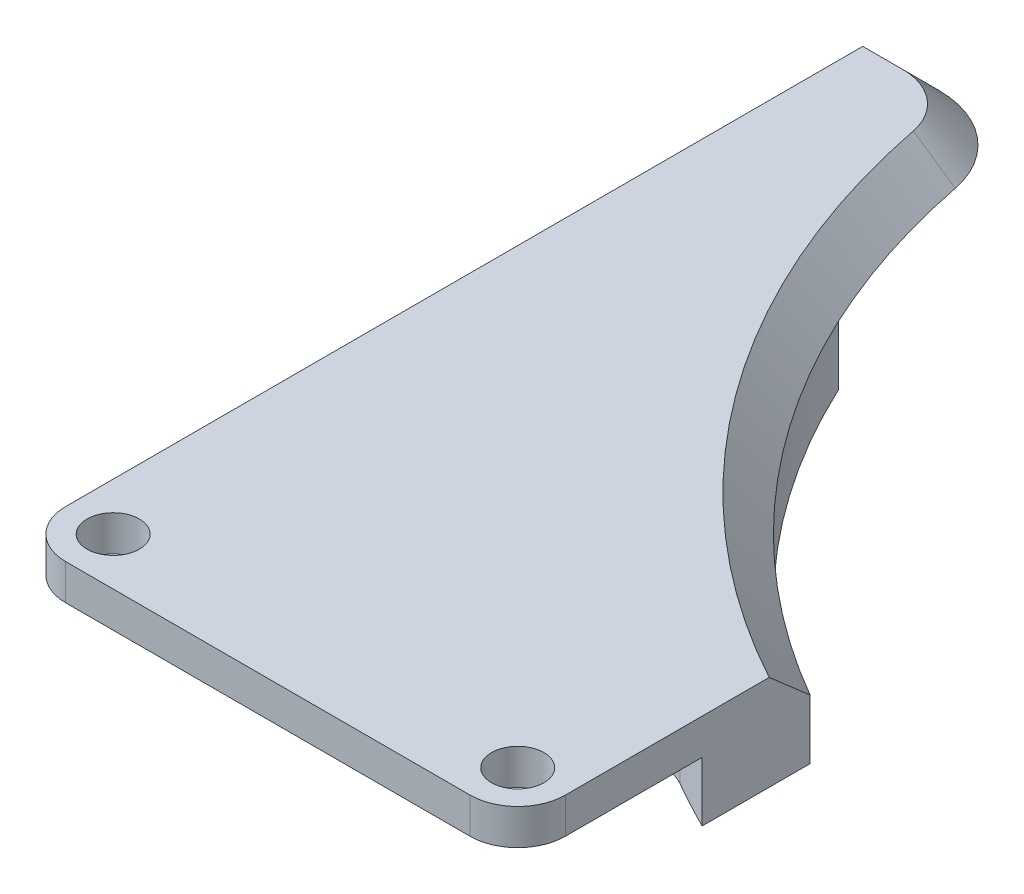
SolidWorks part; units mm, degrees
ref_plane "前视基准面" through (0, 0, 0) normal (0, 0, 1) x (1, 0, 0)
ref_plane "上视基准面" through (0, 0, 0) normal (0, 1, 0) x (1, 0, 0)
ref_plane "右视基准面" through (0, 0, 0) normal (1, 0, 0) x (0, 0, -1)
sketch "草图1" plane through (0, 0, 0) normal (0, 1, 0) x (1, 0, 0)
  line L0 (0, 0) -> (21, 0)
  line L1 (21, 0) -> (21, 13)
  line L2 (8, 22) -> (8, 15)
  line L3 (8, 22) -> (0, 22)
  line L4 (0, 22) -> (0, 0)
  line L5 (8, 15) -> (21, 13)
  dimension "D1" = 21
  dimension "D2" = 13
  dimension "D3" = 22
  dimension "D4" = 8
  dimension "D5" = 7
extrude "凸台-拉伸1" add sketch "草图1" along normal blind 4
sketch "草图5" plane through (0, 0, 0) normal (0, -1, 0) x (1, 0, 0)
  line L0 (0, -22) -> (0, 0) construction
  line L1 (0, 0) -> (21, 0) construction
  line L2 (4, -25.6125) -> (4, -5)
  line L3 (4, -5) -> (16, -5)
  line L4 (16, -5) -> (16, -10.7596)
  line L5 (21, 0) -> (21, -13) construction
  line L6 (21.078, -7.7124) -> (21, 0)
  line L7 (21, 0) -> (0, 0)
  line L8 (0, 0) -> (0, -22)
  line L9 (0, -22) -> (4, -22)
  line L10 (8, -22) -> (0, -22) construction
  circle A0 centre (37, -40) radius 36
  dimension "D1" = 72
  dimension "D2" = 37
  dimension "D3" = 40
  dimension "D4" = 5
  dimension "D5" = 4
  dimension "D6" = 5
extrude "切除-拉伸2" cut sketch "草图5" against normal blind 2.5 contours A0 L2 L3 L4 M8 M9 M4 M5
fillet "圆角1" radius 2 1 edges at (16, 1.25, -10.7596)
sketch "草图6" plane through (0, 4, 0) normal (0, 1, 0) x (1, 0, 0)
  line L1 (0, 22) -> (8, 22)
  line L2 (0, 22) -> (0, 37)
  line L3 (0, 37) -> (8, 37)
  line L4 (8, 22) -> (8, 37)
  dimension "D1" = 8
  dimension "D2" = 15
extrude "凸台-拉伸2" add sketch "草图6" against normal up to surface (1.5 mm away)
sketch "草图7" plane through (0, 4, 0) normal (0, 1, 0) x (1, 0, 0)
  line L0 (0, 37) -> (0, 0) construction
  line L1 (0, 0) -> (21, 0) construction
  circle A0 centre (37, 40) radius 32
  dimension "D1" = 64
  dimension "D2" = 37
  dimension "D3" = 40
extrude "切除-拉伸3" cut sketch "草图7" against normal through all
fillet "圆角2" radius 2 2 edges at (16, 1.25, -5) (4, 1.25, -5)
fillet "圆角4" radius 4 1 edges at (5.1409, 3.25, -37)
sketch "草图10" plane through (0, 4, 0) normal (0, 1, 0) x (1, 0, 0)
  line L0 (0, 37) -> (0, 0) construction
  line L1 (0, 0) -> (21, 0) construction
  line L8 (21, 0) -> (21, 12.2872)
  line L9 (19.4568, 13.2374) -> (8, 15)
  line L10 (8, 15) -> (8, 26.4723)
  line L11 (1.6871, 37) -> (0, 37)
  line L12 (0, 37) -> (0, 0)
  line L13 (0, 0) -> (21, 0)
  line L14 (21, 0) -> (21, 12.2872)
  line L15 (19.4568, 13.2374) -> (8, 15)
  line L16 (8, 15) -> (8, 26.4723)
  line L17 (1.6871, 37) -> (0, 37)
  line L18 (0, 37) -> (0, 0)
  line L19 (0, 0) -> (21, 0)
  circle A0 centre (37, 40) radius 32
  arc A4 (19.4568, 13.2374) -> (21, 12.2872) centre (37, 40) ccw
  arc A5 (19.4568, 13.2374) -> (21, 12.2872) centre (37, 40) ccw
  arc A6 (5.6108, 33.7778) -> (8, 26.4723) centre (37, 40) ccw
  arc A7 (5.6108, 33.7778) -> (8, 26.4723) centre (37, 40) ccw
  arc A8 (5.6108, 33.7778) -> (1.6871, 37) centre (1.6871, 33) ccw
  arc A9 (5.6108, 33.7778) -> (1.6871, 37) centre (1.6871, 33) ccw
  dimension "D1" = 37
  dimension "D2" = 40
  dimension "D3" = 64
  dimension "D4" = 0
extrude "凸台-拉伸3" add sketch "草图10" against normal up to surface (4 mm away) contours A0 M8 M6
chamfer "倒角1" distance 1.5 angle 45 3 edges at (0.8436, 4, -37) (10.9828, 4, -21.3693) (4.2257, 4, -36.0912)
sketch "草图8" plane through (0, 4, 0) normal (0, 1, 0) x (1, 0, 0)
  line L0 (21, 0) -> (21, 10.5679) construction
  line L1 (0, 0) -> (21, 0) construction
  line L2 (0, 35.5) -> (0, 0) construction
  circle A0 centre (2, 2) radius 1.1
  circle A1 centre (19, 2) radius 1.1
  dimension "D1" = 2.2
  dimension "D2" = 2
  dimension "D3" = 2
  dimension "D4" = 2
extrude "切除-拉伸4" cut sketch "草图8" against normal through all
fillet "圆角5" radius 2 2 edges at (21, 3.25, 0) (0, 3.25, 0)
